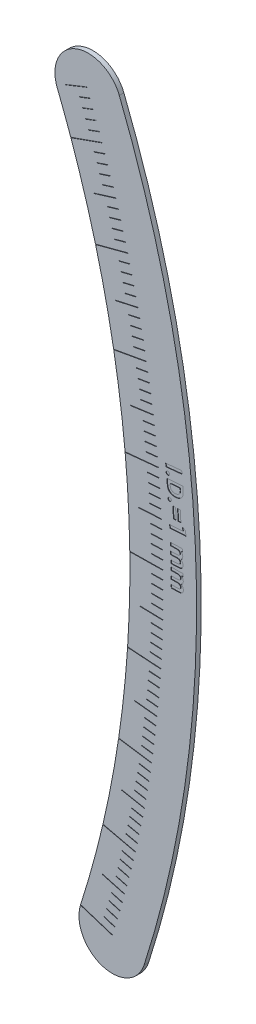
SolidWorks part; units mm, degrees
ref_plane "Plan de face" through (0, 0, 0) normal (0, 0, 1) x (1, 0, 0)
ref_plane "Plan de dessus" through (0, 0, 0) normal (0, 1, 0) x (1, 0, 0)
ref_plane "Plan de droite" through (0, 0, 0) normal (1, 0, 0) x (0, 0, -1)
sketch "Esquisse1" plane through (0, 0, 0) normal (0, 0, 1) x (1, 0, 0)
  arc A0 (227.5837, -72.984) -> (222.2004, 88.0227) centre (0, 0) ccw
  arc A1 (213.7763, -68.5561) -> (208.7196, 82.6824) centre (0, 0) ccw
  arc A2 (222.2004, 88.0227) -> (208.7196, 82.6824) centre (215.46, 85.3525) ccw
  arc A3 (213.7763, -68.5561) -> (227.5837, -72.984) centre (220.68, -70.7701) ccw
  dimension "D1" = 449
  dimension "D2" = 478
  dimension "D3" = 220.68
  dimension "D4" = 215.46
extrude "Extrusion1" add sketch "Esquisse1" along normal blind 1
sketch "Esquisse2" plane through (0, 0, 1) normal (0, 0, 1) x (1, 0, 0)
  line L0 (0, 0) -> (220.68, -70.7701) construction
  line L1 (220.6953, -70.7224) -> (220.6647, -70.8177)
  line L2 (220.6953, -70.7224) -> (218.3147, -69.959)
  line L3 (220.6647, -70.8177) -> (218.2841, -70.0542)
  line L4 (218.2841, -70.0542) -> (218.3147, -69.959)
  circle A0 centre (0, 0) radius 231.75 construction
  dimension "D1" = 2.5
  dimension "D2" = 0.1
extrude "Enlèv. mat.-Extru.1" cut sketch "Esquisse2" against normal blind 0.1
pattern_circular "Répétition circulaire1" count 86 every 0.466 about axis through (0, 0, 0) along (0, 0, 1) of "Enlèv. mat.-Extru.1"
sketch "Esquisse3" plane through (0, 0, 1) normal (0, 0, 1) x (1, 0, 0)
  line L0 (201.6506, -64.615) -> (201.6201, -64.7102)
  line L4 (220.6953, -70.7224) -> (218.3147, -69.959)
  line L5 (218.3147, -69.959) -> (218.2841, -70.0542)
  line L6 (218.2841, -70.0542) -> (220.6647, -70.8177)
  line L7 (220.6647, -70.8177) -> (220.6953, -70.7224)
  line L8 (220.6953, -70.7224) -> (201.6506, -64.615)
  line L9 (218.3147, -69.959) -> (218.2841, -70.0542) construction
  line L10 (201.6201, -64.7102) -> (220.6647, -70.8177)
  line L11 (220.6647, -70.8177) -> (220.6953, -70.7224)
  dimension "D2" = 20
  dimension "D1" = 0
extrude "Enlèv. mat.-Extru.2" cut sketch "Esquisse3" against normal blind 0.1
pattern_circular "Répétition circulaire2" count 9 every 4.657 about axis through (0, 0, 1) along (0, 0, -1) of "Enlèv. mat.-Extru.2"
sketch "Esquisse4" plane through (0, 0, 1) normal (0, 0, 1) x (1, 0, 0)
  line L0 (218.5671, -60.3653) -> (218.5405, -60.4617)
  line L4 (223.3864, -61.6975) -> (220.9768, -61.0314)
  line L5 (220.9768, -61.0314) -> (220.9501, -61.1278)
  line L6 (220.9501, -61.1278) -> (223.3598, -61.7938)
  line L7 (223.3598, -61.7938) -> (223.3864, -61.6975)
  line L8 (223.3864, -61.6975) -> (218.5671, -60.3653)
  line L10 (218.5405, -60.4617) -> (223.3598, -61.7938)
  line L11 (223.3598, -61.7938) -> (223.3864, -61.6975)
  dimension "D2" = 5
  dimension "D1" = 0
extrude "Enlèv. mat.-Extru.3" cut sketch "Esquisse4" against normal blind 0.1
pattern_circular "Répétition circulaire3" count 20 every 4.657 about axis through (0, 0, 0) along (0, 0, 1) of "Enlèv. mat.-Extru.3"
sketch "Esquisse5" plane through (0, 0, 1) normal (0, 0, 1) x (1, 0, 0)
  line L0 (0, 0) -> (269.5359, 127.3383) construction
  line L1 (0, 0) -> (266.6584, 0.7264) construction
  arc A0 (233.4991, 0.636) -> (211.1247, 99.7428) centre (0, 0) ccw construction
  text T0 "I.D.=1 mm" font "Century Gothic" height 3.5
  dimension "D1" = 467
extrude "Enlèv. mat.-Extru.4" cut sketch "Esquisse5" against normal blind 0.1
